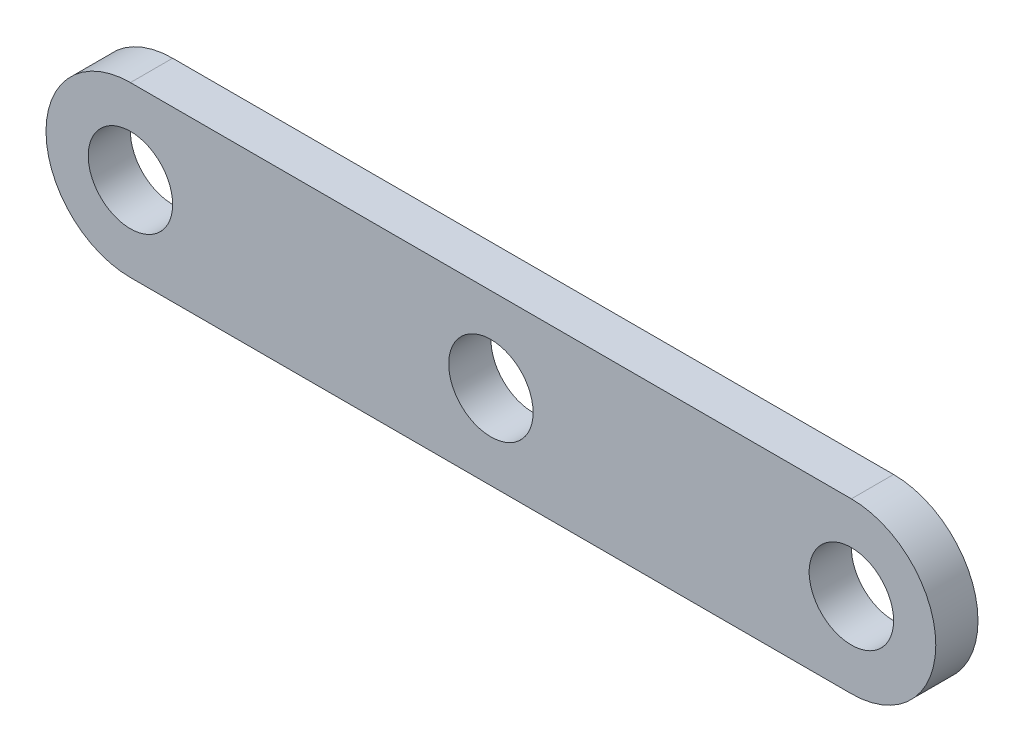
SolidWorks part; units mm, degrees
ref_plane "Front Plane" through (0, 0, 0) normal (0, 0, 1) x (1, 0, 0)
ref_plane "Top Plane" through (0, 0, 0) normal (0, 1, 0) x (1, 0, 0)
ref_plane "Right Plane" through (0, 0, 0) normal (1, 0, 0) x (0, 0, -1)
sketch "Sketch1" plane through (0, 0, 0) normal (0, 0, 1) x (1, 0, 0)
  line L0 (0, 12.7) -> (108.458, 12.7)
  line L1 (0, -12.7) -> (108.458, -12.7)
  arc A0 (0, 12.7) -> (0, -12.7) centre (0, 0) ccw
  arc A1 (108.458, -12.7) -> (108.458, 12.7) centre (108.458, 0) ccw
  circle A2 centre (0, 0) radius 6.35
  circle A3 centre (108.458, 0) radius 6.35
  circle A4 centre (54.229, 0) radius 6.35
  point P11 (0, 0)
  point P12 (54.229, 12.7)
  point P13 (0, 0)
  dimension "D1" = 25.4
  dimension "D3" = 12.7
  dimension "D2" = 108.458
extrude "Boss-Extrude1" add sketch "Sketch1" along normal blind 6.35
